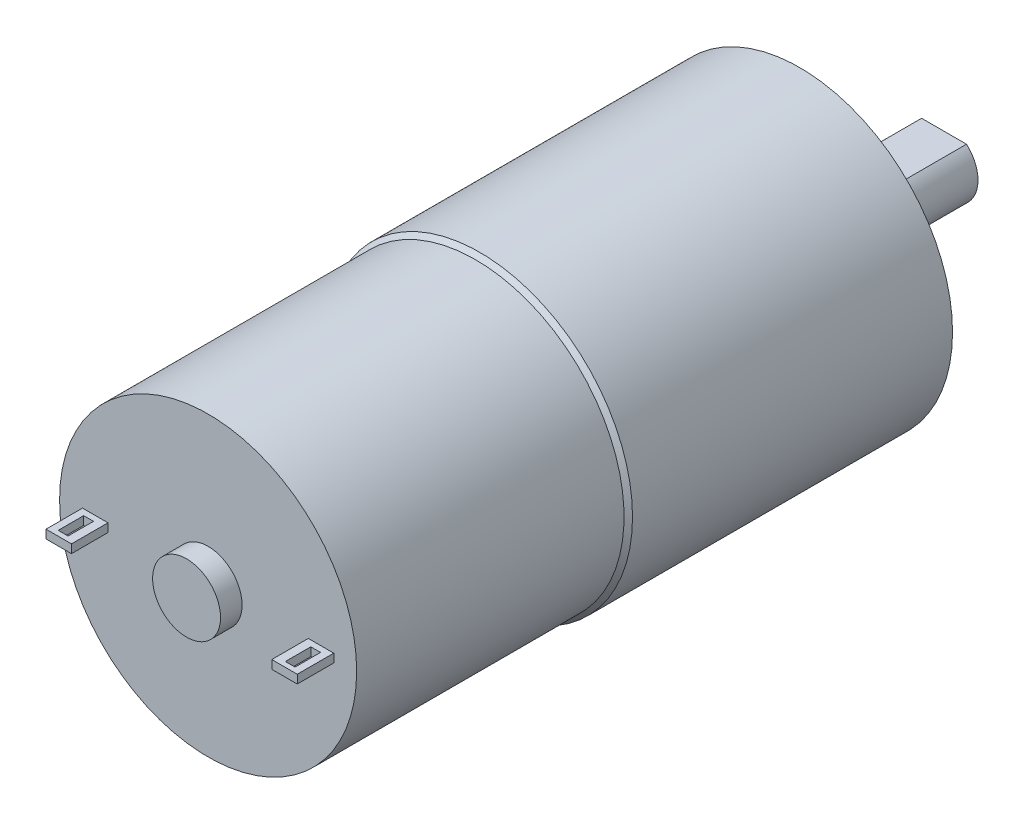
SolidWorks part; units mm, degrees
ref_plane "Front Plane" through (0, 0, 0) normal (0, 0, 1) x (1, 0, 0)
ref_plane "Top Plane" through (0, 0, 0) normal (0, 1, 0) x (1, 0, 0)
ref_plane "Right Plane" through (0, 0, 0) normal (1, 0, 0) x (0, 0, -1)
sketch "Sketch1" plane through (0, 0, 0) normal (0, 0, 1) x (1, 0, 0)
  circle A0 centre (0, 0) radius 18
  dimension "D1" = 36
extrude "Boss-Extrude1" add sketch "Sketch1" along normal blind 38.7
sketch "Sketch2" plane through (0, 0, 38.7) normal (0, 0, 1) x (1, 0, 0)
  circle A0 centre (0, 0) radius 17.5
  dimension "D1" = 35
extrude "Boss-Extrude2" add sketch "Sketch2" along normal blind 31
chamfer "Chamfer1" distance 1 angle 45 1 edges at (18, 0, 38.7)
sketch "Sketch3" plane through (0, 0, 0) normal (0, 0, -1) x (-1, 0, 0)
  circle A0 centre (0, 0) radius 11
  dimension "D1" = 22
extrude "Boss-Extrude3" add sketch "Sketch3" along normal blind 2
sketch "Sketch4" plane through (0, 0, -2) normal (0, 0, -1) x (-1, 0, 0)
  circle A0 centre (0, 0) radius 4
  dimension "D1" = 8
extrude "Boss-Extrude4" add sketch "Sketch4" along normal blind 15
sketch "Sketch5" plane through (0, 0, -17) normal (0, 0, -1) x (-1, 0, 0)
  line L0 (0, 3) -> (0, 4)
  line L1 (-2.6458, 3) -> (2.6458, 3)
  circle A0 centre (0, 0) radius 4 construction
  arc A1 (2.6458, 3) -> (-2.6458, 3) centre (0, 0) ccw
  dimension "D1" = 1
extrude "Cut-Extrude1" cut sketch "Sketch5" against normal blind 12 contours L1 A1
sketch "Sketch6" plane through (0, 0, 69.7) normal (0, 0, 1) x (1, 0, 0)
  circle A0 centre (0, 0) radius 4
  dimension "D1" = 8
extrude "Boss-Extrude5" add sketch "Sketch6" along normal blind 2.54
sketch "Sketch7" plane through (0, 0, 69.7) normal (0, 0, 1) x (1, 0, 0)
  line L0 (-17.5, 0) -> (17.5, 0)
  line L2 (11.8, 0.5) -> (14.8, 0.5)
  line L3 (11.8, 0.5) -> (11.8, -0.5)
  line L4 (11.8, -0.5) -> (14.8, -0.5)
  line L5 (14.8, 0.5) -> (14.8, -0.5)
  line L6 (11.8, 0.5) -> (14.8, -0.5) construction
  line L7 (11.8, -0.5) -> (14.8, 0.5) construction
  line L8 (-14.8, 0.5) -> (-11.8, 0.5)
  line L9 (-14.8, 0.5) -> (-14.8, -0.5)
  line L10 (-14.8, -0.5) -> (-11.8, -0.5)
  line L11 (-11.8, 0.5) -> (-11.8, -0.5)
  line L12 (-14.8, 0.5) -> (-11.8, -0.5) construction
  line L13 (-14.8, -0.5) -> (-11.8, 0.5) construction
  circle A0 centre (0, 0) radius 17.5 construction
  circle A1 centre (0, 0) radius 17.5 construction
  point P7 (13.3, 0)
  point P12 (-13.3, 0)
  dimension "D1" = 3
  dimension "D2" = 3
  dimension "D3" = 2.7
  dimension "D4" = 2.7
  dimension "D5" = 1
  dimension "D6" = 1
extrude "Boss-Extrude6" add sketch "Sketch7" along normal blind 4.3 contours L4 L5 L2 L3 | L8 L11 L10 L9
sketch "Sketch8" plane through (0, 0.5, 0) normal (0, 1, 0) x (1, 0, 0)
  line L0 (-14.8, -74) -> (-11.8, -74) construction
  line L1 (12.8, -73.4) -> (13.9429, -73.4)
  line L2 (12.8, -73.4) -> (12.8, -70.4)
  line L3 (12.8, -70.4) -> (13.9429, -70.4)
  line L4 (13.9429, -73.4) -> (13.9429, -70.4)
  line L5 (12.8, -73.4) -> (13.9429, -70.4) construction
  line L6 (12.8, -70.4) -> (13.9429, -73.4) construction
  line L7 (-13.9628, -70.4) -> (-12.8, -70.4)
  line L8 (-13.9628, -70.4) -> (-13.9628, -73.4)
  line L9 (-13.9628, -73.4) -> (-12.8, -73.4)
  line L10 (-12.8, -70.4) -> (-12.8, -73.4)
  line L11 (-13.9628, -70.4) -> (-12.8, -73.4) construction
  line L12 (-13.9628, -73.4) -> (-12.8, -70.4) construction
  line L13 (11.8, -74) -> (14.8, -74) construction
  line L14 (11.8, -74) -> (11.8, -69.7) construction
  line L15 (-11.8, -74) -> (-11.8, -69.7) construction
  point P0 (13.3714, -71.9)
  point P5 (-13.3814, -71.9)
  dimension "D1" = 0.6
  dimension "D2" = 0.6
  dimension "D3" = 1
  dimension "D4" = 1
  dimension "D5" = 3
  dimension "D6" = 3
extrude "Cut-Extrude2" cut sketch "Sketch8" against normal blind 4.3
